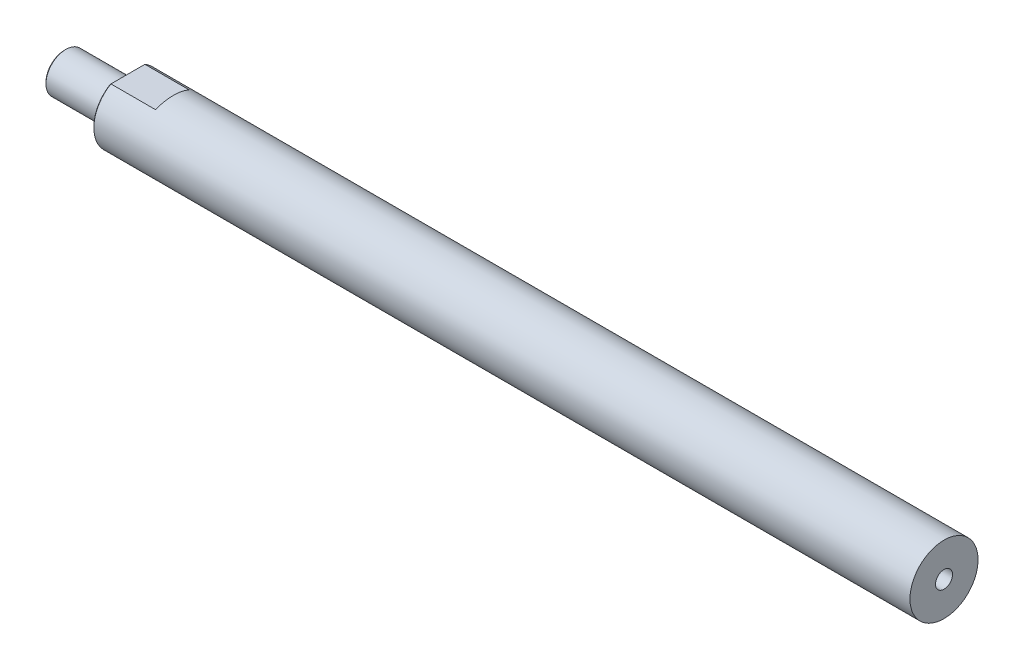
SolidWorks part; units mm, degrees
ref_plane "Front Plane" through (0, 0, 0) normal (0, 0, 1) x (1, 0, 0)
ref_plane "Top Plane" through (0, 0, 0) normal (0, 1, 0) x (1, 0, 0)
ref_plane "Right Plane" through (0, 0, 0) normal (1, 0, 0) x (0, 0, -1)
sketch "Sketch1" plane through (0, 0, 0) normal (0, 0, 1) x (1, 0, 0)
  line L0 (-34.7534, 0) -> (143.7331, 0) construction
  line L1 (-35.0012, 11.1125) -> (0, 11.1125)
  line L2 (0, 11.1125) -> (0, 19.05)
  line L3 (0, 19.05) -> (457.2, 19.05)
  line L4 (457.2, 19.05) -> (457.2, 0)
  line L5 (457.2, 0) -> (-35.0012, 0)
  line L6 (-35.0012, 0) -> (-35.0012, 11.1125)
  dimension "D1" = 22.225
  dimension "D2" = 38.1
  dimension "D3" = 35.0012
  dimension "D4" = 457.2
revolve "Revolve1" add sketch "Sketch1" angle 360 about L0
hole_wizard "1/2-20 Tapped Hole1" positions "Sketch3" profile "Sketch2" tap size "1/2-20" standard "ANSI Inch"
sketch "Sketch3" plane through (-35.0012, 0, 0) normal (-1, 0, 0) x (0, 0, 1)
  point P0 (0, 0)
sketch "Sketch2" plane through (-35.0012, 0, 0) normal (0, 1, 0) x (0, 0, 1)
  line L0 (0, 0) -> (0, 25.8096)
  line L1 (0, 25.8096) -> (5.7544, 22.352)
  line L2 (5.7544, 22.352) -> (5.7544, 0)
  line L5 (5.7544, 0) -> (0, 0)
  line L10 (0, 25.8096) -> (-5.7544, 22.352) construction
  line L11 (0, -6.35) -> (0, 107.95) construction
  dimension "Tap Drill Dia." = 11.5087
  dimension "Tap Drill Depth" = 22.352
  dimension "Drill Angle" = 118
fillet "Fillet1" radius 0.762 1 edges at (0, 0, 11.1125)
sketch "Sketch5" plane through (457.2, 0, 0) normal (1, 0, 0) x (0, 0, -1)
  circle A0 centre (0, 0) radius 4.7625
  dimension "D1" = 9.525
extrude "Cut-Extrude1" cut sketch "Sketch5" against normal through all
sketch "Sketch6" plane through (0, 0, 0) normal (0, 0, 1) x (1, 0, 0)
  line L0 (-1.016, 16.51) -> (25.4, 16.51)
  line L2 (25.4, 16.51) -> (26.0806, 19.05)
  line L3 (457.2, 19.05) -> (0, 19.05) construction
  line L4 (26.0806, 19.05) -> (-1.016, 19.05)
  line L5 (-1.016, 19.05) -> (-1.016, 16.51)
  line L6 (0, -19.05) -> (457.2, -19.05) construction
  dimension "D1" = 75
  dimension "D2" = 35.56
  dimension "D3" = 25.4
  dimension "D4" = 1.016
extrude "Cut-Extrude2" cut sketch "Sketch6" against normal through all both and the other way through all
chamfer "Chamfer1" distance 0.762 angle 45 1 edges at (-35.0012, 0, 11.1125)
chamfer "Chamfer2" distance 0.508 angle 45 2 edges at (0, 16.51, 0) (0, -19.05, 0)
